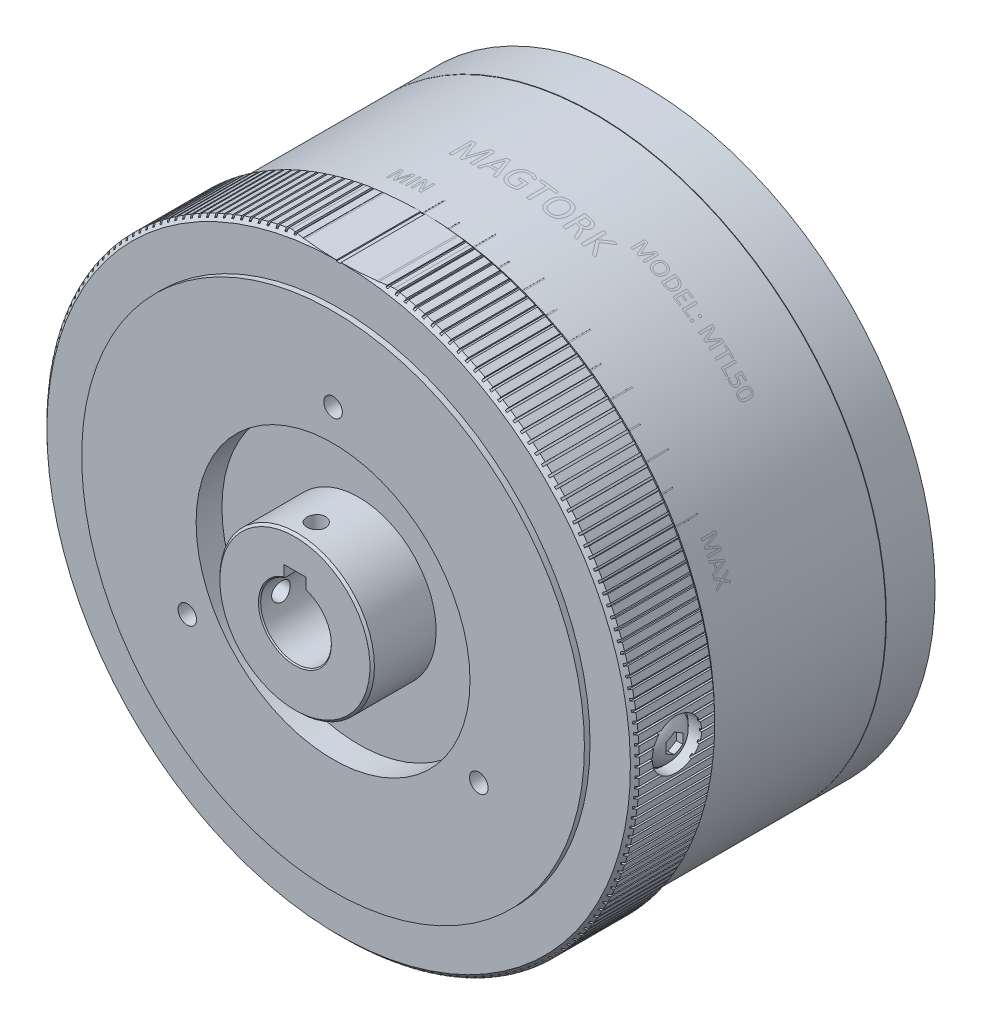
SolidWorks part; units mm, degrees
ref_plane "Front Plane" through (0, 0, 0) normal (0, 0, 1) x (1, 0, 0)
ref_plane "Top Plane" through (0, 0, 0) normal (0, 1, 0) x (1, 0, 0)
ref_plane "Right Plane" through (0, 0, 0) normal (1, 0, 0) x (0, 0, -1)
sketch "Sketch1" plane through (0, 0, 0) normal (1, 0, 0) x (0, 0, -1)
  line L0 (0, 0) -> (94.6287, 0) construction
  line L1 (0, 0) -> (0, 8.001) construction
  line L2 (0, 8.001) -> (0, 17.4981)
  line L3 (0, 17.4981) -> (8.636, 17.4981)
  line L4 (8.636, 17.4981) -> (8.636, 56.896)
  line L5 (8.636, 56.896) -> (9.906, 56.896)
  line L6 (9.906, 56.896) -> (9.906, 67.056)
  line L7 (9.906, 67.056) -> (28.956, 67.056)
  line L8 (28.956, 67.056) -> (28.956, 65.913)
  line L9 (28.956, 65.913) -> (67.8434, 65.913)
  line L10 (78.994, 65.913) -> (78.994, 8.001)
  line L11 (78.994, 8.001) -> (0, 8.001)
  line L12 (67.9704, 65.913) -> (78.994, 65.913)
  line L14 (67.8434, 65.913) -> (67.8434, 65.786)
  line L15 (67.8434, 65.786) -> (67.9704, 65.786)
  line L16 (67.9704, 65.913) -> (67.9704, 65.786)
  dimension "D1" = 16.002
  dimension "D2" = 34.9961
  dimension "D3" = 113.792
  dimension "D4" = 134.112
  dimension "D5" = 131.826
  dimension "D6" = 78.994
  dimension "D7" = 70.358
  dimension "D8" = 69.088
  dimension "D9" = 19.05
  dimension "D10" = 11.0236
  dimension "D11" = 0.127
  dimension "D12" = 0.127
revolve "Revolve1" add sketch "Sketch1" angle 360 about L0
chamfer "Chamfer2" distance 1.016 angle 45 2 edges at (67.056, 0, -28.956) (67.056, 0, -9.906)
sketch "Sketch2" plane through (0, 0, -9.906) normal (0, 0, 1) x (1, 0, 0)
  line L0 (0, -67.056) -> (0, -66.1826) construction
  line L1 (0.254, -67.056) -> (0.254, -66.548)
  line L2 (-0.254, -67.056) -> (-0.254, -66.548)
  line L3 (-0.254, -67.056) -> (0.254, -67.056)
  line L4 (-0.254, -66.548) -> (0.254, -66.548)
  line L5 (-0.254, -67.056) -> (-0.254, -66.1826) construction
  line L6 (0.254, -67.056) -> (0.254, -66.1826) construction
  circle A0 centre (0, 0) radius 67.056 construction
  dimension "D3" = 0.508
  dimension "D1" = 0.254
  dimension "D2" = 0.254
extrude "Cut-Extrude1" cut sketch "Sketch2" against normal up to next
pattern_circular "CirPattern1" count 200 over 360 about axis through (0, 0, 0) along (0, 0, 1) of "Cut-Extrude1"
sketch "Sketch5" plane through (0, 0, -8.636) normal (0, 0, 1) x (1, 0, 0)
  circle A0 centre (0, 0) radius 17.4981
  circle A1 centre (0, 0) radius 30.9982
  dimension "D1" = 34.9961
  dimension "D2" = 61.9963
extrude "Cut-Extrude4" cut sketch "Sketch5" against normal blind 5.842
sketch "Sketch6" plane through (0, 0, -9.906) normal (0, 0, 1) x (1, 0, 0)
  line L0 (0, 0) -> (0, 66.04) construction
  line L1 (0, 66.04) -> (16.9071, 66.04)
  line L2 (0, 66.04) -> (-20.3887, 66.04)
  line L3 (-20.3887, 66.04) -> (-20.3887, 69.5398)
  line L4 (-20.3887, 69.5398) -> (16.9071, 69.5398)
  line L5 (16.9071, 69.5398) -> (16.9071, 66.04)
  dimension "D1" = 66.04
extrude "Cut-Extrude5" cut sketch "Sketch6" against normal blind 19.05
sketch "Sketch7" plane through (0, 0, -9.906) normal (0, 0, 1) x (1, 0, 0)
  line L0 (0, 66.04) -> (0, 65.786) construction
  line L1 (0, 65.786) -> (0.508, 65.786)
  line L2 (0, 65.786) -> (-0.508, 65.786)
  line L3 (-0.508, 65.786) -> (-0.508, 66.381)
  line L4 (-0.508, 66.381) -> (0.508, 66.381)
  line L5 (0.508, 66.381) -> (0.508, 65.786)
  dimension "D1" = 1.016
  dimension "D2" = 0.254
extrude "Cut-Extrude6" cut sketch "Sketch7" against normal blind 19.05
chamfer "Chamfer4" distance 0.254 angle 45 2 edges at (8.001, 0, -78.994) (8.001, 0, 0)
sketch "Sketch9" plane through (0, 0, -78.994) normal (0, 0, -1) x (-1, 0, 0)
  circle A0 centre (0, 0) radius 30.988
  dimension "D1" = 61.976
extrude "Cut-Extrude7" cut sketch "Sketch9" against normal blind 5.588
sketch "Sketch10" plane through (0, 0, -73.406) normal (0, 0, -1) x (-1, 0, 0)
  circle A0 centre (0, 0) radius 17.4879
  circle A1 centre (0, 0) radius 17.526
  dimension "D1" = 34.9758
  dimension "D2" = 35.052
extrude "Cut-Extrude8" cut sketch "Sketch10" against normal blind 0.127
ref_plane "Plane1" through (0, 17.5006, 0) normal (0, 1, 0) x (-1, 0, 0)
hole_wizard "M5x0.8 Tapped Hole1" positions "Sketch14" profile "Sketch13" tap size "M5x0.8" standard "Ansi Metric"
sketch "Sketch14" plane through (0, 0, -8.636) normal (0, 0, 1) x (1, 0, 0)
  line L0 (0, 0) -> (0, 38.1) construction
  point P0 (0, 38.1)
  dimension "D1" = 38.1
sketch "Sketch13" plane through (0, 38.1, -8.636) normal (1, 0, 0) x (0, -1, 0)
  line L0 (0, 0) -> (0, 15.4858)
  line L1 (0, 15.4858) -> (2.1, 14.224)
  line L2 (2.1, 14.224) -> (2.1, 0)
  line L5 (2.1, 0) -> (0, 0)
  line L10 (0, 15.4858) -> (-2.1, 14.224) construction
  line L11 (0, -6.35) -> (0, 107.95) construction
  dimension "Tap Drill Dia." = 4.2
  dimension "Tap Drill Depth" = 14.224
  dimension "Drill Angle" = 118
pattern_circular "CirPattern3" count 3 over 360 about axis through (0, 0, 0) along (0, 0, 1) of "M5x0.8 Tapped Hole1"
hole_wizard "M5x0.8 Tapped Hole2" positions "Sketch16" profile "Sketch15" tap size "M5x0.8" standard "Ansi Metric"
sketch "Sketch16" plane through (0, 0, -78.994) normal (0, 0, -1) x (-1, 0, 0)
  line L0 (0, 0) -> (0, 38.1) construction
  point P0 (0, 38.1)
  dimension "D1" = 38.1
sketch "Sketch15" plane through (0, 38.1, -78.994) normal (1, 0, 0) x (0, 1, 0)
  line L0 (0, 0) -> (0, 15.4858)
  line L1 (0, 15.4858) -> (2.1, 14.224)
  line L2 (2.1, 14.224) -> (2.1, 0)
  line L5 (2.1, 0) -> (0, 0)
  line L10 (0, 15.4858) -> (-2.1, 14.224) construction
  line L11 (0, -6.35) -> (0, 107.95) construction
  dimension "Tap Drill Dia." = 4.2
  dimension "Tap Drill Depth" = 14.224
  dimension "Drill Angle" = 118
pattern_circular "CirPattern4" count 3 over 360 about axis through (0, 0, 0) along (0, 0, 1) of "M5x0.8 Tapped Hole2"
ref_plane "Plane2" through (67.056, 0, 0) normal (1, 0, 0) x (0, 0, -1)
sketch "Sketch17" plane through (67.056, 0, 0) normal (1, 0, 0) x (0, 0, -1)
  line L0 (0, 0) -> (9.906, -0.001) construction
  line L1 (9.906, 66.038) -> (9.906, -66.04) construction
  line L2 (9.906, -0.001) -> (28.956, -0.001) construction
  line L3 (28.956, -65.913) -> (28.956, 65.911) construction
  circle A0 centre (19.431, -0.001) radius 5.588
  dimension "D1" = 11.176
extrude "Cut-Extrude9" cut sketch "Sketch17" against normal blind 3.048
ref_plane "Plane3" through (0, 0, -19.431) normal (0, 0, 1) x (1, 0, 0)
sketch "Sketch18" plane through (0, 0, -19.431) normal (0, 0, 1) x (1, 0, 0)
  line L0 (64.008, -0.001) -> (66.802, -0.001) construction
  line L1 (64.008, -5.589) -> (64.008, 5.587) construction
  line L2 (64.008, -0.001) -> (64.008, 5.079)
  line L3 (64.008, 5.079) -> (64.5334, 5.079)
  line L4 (64.008, -0.001) -> (66.802, -0.001)
  arc A0 (64.5334, 5.079) -> (66.802, -0.001) centre (60.1438, 0.0721) cw
  dimension "D1" = 2.794
  dimension "D2" = 5.08
revolve "Revolve2" add sketch "Sketch18" angle 360 about L0
sketch "Sketch19" plane through (67.056, 0, 0) normal (1, 0, 0) x (0, 0, -1)
  line L1 (21.3724, 1.0805) -> (19.4652, 2.2211)
  line L2 (19.4652, 2.2211) -> (17.5237, 1.1396)
  line L3 (17.5237, 1.1396) -> (17.4896, -1.0824)
  line L4 (17.4896, -1.0824) -> (19.3968, -2.223)
  line L5 (19.3968, -2.223) -> (21.3383, -1.1416)
  line L6 (21.3383, -1.1416) -> (21.3724, 1.0805)
  circle A0 centre (19.431, -0.001) radius 1.9246 construction
extrude "Cut-Extrude10" cut sketch "Sketch19" against normal blind 2.032
mirror "Mirror1" about plane through (0, 0, 0) normal (1, 0, 0) of "Cut-Extrude9", "Revolve2", "Cut-Extrude10"
sketch "Sketch20" plane through (0, 0, -78.994) normal (0, 0, -1) x (-1, 0, 0)
  line L0 (0, 0) -> (0, 62.23) construction
  circle A0 centre (0, 62.23) radius 3.175
  dimension "D2" = 6.35
  dimension "D1" = 62.23
extrude "Cut-Extrude11" cut sketch "Sketch20" against normal blind 5.08
sketch "Sketch21" plane through (0, 0, -73.914) normal (0, 0, -1) x (-1, 0, 0)
  circle A0 centre (0, 62.23) radius 2.794
  dimension "D1" = 5.588
extrude "Boss-Extrude2" add sketch "Sketch21" along normal blind 3.048
sketch "Sketch22" plane through (0, 0, -76.962) normal (0, 0, -1) x (-1, 0, 0)
  line L1 (0.9365, 63.6751) -> (-0.7832, 63.7636)
  line L2 (-0.7832, 63.7636) -> (-1.7197, 62.3185)
  line L3 (-1.7197, 62.3185) -> (-0.9365, 60.7849)
  line L4 (-0.9365, 60.7849) -> (0.7832, 60.6964)
  line L5 (0.7832, 60.6964) -> (1.7197, 62.1415)
  line L6 (1.7197, 62.1415) -> (0.9365, 63.6751)
  circle A0 centre (0, 62.23) radius 1.4913 construction
extrude "Cut-Extrude12" cut sketch "Sketch22" against normal blind 2.032
pattern_circular "CirPattern5" count 4 over 360 about axis through (0, 0, 0) along (0, 0, 1) of "Cut-Extrude12", "Boss-Extrude2", "Cut-Extrude11"
ref_plane "Plane4" through (0, 0, -28.956) normal (0, 0, 1) x (1, 0, 0)
sketch "Sketch23" plane through (0, 0, -28.956) normal (0, 0, 1) x (1, 0, 0)
  line L0 (0, 65.913) -> (0, 65.8876) construction
  line L1 (0, 65.8876) -> (-0.127, 65.8876)
  line L2 (0, 65.8876) -> (0.127, 65.8876)
  line L3 (-0.127, 65.8876) -> (-0.127, 65.9455)
  line L4 (-0.127, 65.9455) -> (0.127, 65.9455)
  line L5 (0.127, 65.9455) -> (0.127, 65.8876)
  arc A0 (0.508, 65.911) -> (-0.508, 65.911) centre (0, 0) ccw construction
  dimension "D1" = 0.0254
  dimension "D2" = 0.254
extrude "Cut-Extrude14" cut sketch "Sketch23" against normal blind 5.08
pattern_circular "CirPattern6" count 7 over 60 about axis through (0, 0, 0) along (0, 0, 1) of "Cut-Extrude14"
sketch "Sketch24" plane through (0, 0, -28.956) normal (0, 0, 1) x (1, 0, 0)
  line L0 (0, 0) -> (5.7447, 65.6622) construction
  line L1 (0, 0) -> (0, 22.5472) construction
  line L2 (5.869, 65.6258) -> (5.8712, 65.6511)
  line L3 (-0.1265, 0.0111) -> (0, 1.4572)
  line L4 (5.6182, 65.6732) -> (5.8712, 65.6511)
  line L5 (5.616, 65.6479) -> (5.869, 65.6258)
  line L6 (5.616, 65.6479) -> (5.6182, 65.6732)
  line L7 (-0.1265, 0.0111) -> (5.6182, 65.6732) construction
  line L8 (0.1265, -0.0111) -> (5.8712, 65.6511) construction
  circle A0 centre (0, 0) radius 65.913 construction
  dimension "D1" = 5
  dimension "D2" = 0.127
  dimension "D3" = 0.127
  dimension "D4" = 0.0254
extrude "Cut-Extrude15" cut sketch "Sketch24" against normal blind 2.54 contours L6 L5 L2 L4
pattern_circular "CirPattern7" count 6 over 50 about axis through (0, 0, 0) along (0, 0, 1) of "Cut-Extrude15"
ref_plane "Plane5" through (0, 65.913, 0) normal (0, 1, 0) x (-1, 0, 0)
sketch "Sketch25" plane through (0, 65.913, 0) normal (0, 1, 0) x (-1, 0, 0)
  line L0 (4.0081, -33.0229) -> (20.8089, -33.0229) construction
  text T0 "MIN"
wrap "Wrap1" sketch "Sketch25" wrap type scribe source sketch "Sketch25"
sketch "Sketch26" plane through (0, 65.913, 0) normal (0, 1, 0) x (-1, 0, 0)
  line L0 (-72.4395, -33.0505) -> (-87.7188, -33.0505) construction
  text T0 "MAX"
wrap "Wrap2" sketch "Sketch26" wrap type scribe source sketch "Sketch26"
sketch "Sketch27" plane through (0, 65.913, 0) normal (0, 1, 0) x (-1, 0, 0)
  line L0 (10.1146, -44.2396) -> (-29.6719, -44.2396) construction
  text T0 "MAGTORK" font "Calibri" height 5.08
wrap "Wrap4" sketch "Sketch27" wrap type scribe source sketch "Sketch27"
sketch "Sketch28" plane through (0, 65.913, 0) normal (0, 1, 0) x (-1, 0, 0)
  line L0 (-25.479, -50.7834) -> (-62.2561, -50.7834) construction
  text T0 "MODEL: MTL50"
wrap "Wrap5" sketch "Sketch28" wrap type scribe source sketch "Sketch28"
hole_wizard "M5x0.8 Tapped Hole3" positions "Sketch31" profile "Sketch30" tap size "M5x0.8" standard "ANSI Metric"
sketch "Sketch31" plane through (0, 17.5006, 0) normal (0, 1, 0) x (-1, 0, 0)
  point P0 (0, -4.826)
  dimension "D1" = 4.826
sketch "Sketch30" plane through (0, 17.5006, -4.826) normal (1, 0, 0) x (0, 0, 1)
  line L0 (0, 0) -> (0, 34.9987)
  line L1 (0, 34.9987) -> (2.1, 34.9987)
  line L2 (2.1, 34.9987) -> (2.1, 0)
  line L5 (2.1, 0) -> (0, 0)
  line L11 (0, -6.35) -> (0, 107.95) construction
  dimension "Thru Tap Drill Dia." = 4.2
  dimension "Thru Tap Drill Depth" = 34.9987
pattern_circular "CirPattern8" count 2 over 90 about axis through (0, 0, 0) along (0, 0, 1) of "M5x0.8 Tapped Hole3"
chamfer "Chamfer5" distance 0.508 angle 45 1 edges at (17.4981, 0, 0)
sketch "Sketch32" plane through (0, 0, 0) normal (0, 0, 1) x (1, 0, 0)
  line L0 (0, -8.001) -> (0, 10.3124) construction
  line L1 (0, 10.3124) -> (2.5019, 10.3124)
  line L2 (0, 10.3124) -> (-2.5019, 10.3124)
  line L3 (-2.5019, 10.3124) -> (-2.5019, 6.5024)
  line L4 (-2.5019, 6.5024) -> (2.5019, 6.5024)
  line L5 (2.5019, 6.5024) -> (2.5019, 10.3124)
  circle A0 centre (0, 0) radius 8.001 construction
  dimension "D1" = 5.0038
  dimension "D2" = 18.3134
  dimension "D3" = 3.81
extrude "Cut-Extrude16" cut sketch "Sketch32" against normal through all
